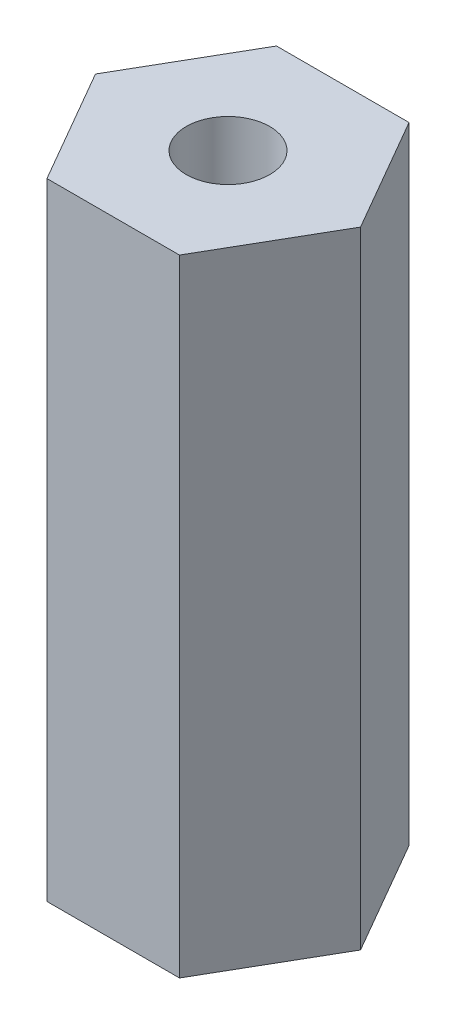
SolidWorks part; units mm, degrees
ref_plane "Alzado" through (0, 0, 0) normal (0, 0, 1) x (1, 0, 0)
ref_plane "Planta" through (0, 0, 0) normal (0, 1, 0) x (1, 0, 0)
ref_plane "Vista lateral" through (0, 0, 0) normal (1, 0, 0) x (0, 0, -1)
sketch "Croquis1" plane through (0, 0, 0) normal (0, 1, 0) x (1, 0, 0)
  line L1 (1.5877, 2.75) -> (-1.5877, 2.75)
  line L2 (-1.5877, 2.75) -> (-3.1754, 0)
  line L3 (-3.1754, 0) -> (-1.5877, -2.75)
  line L4 (-1.5877, -2.75) -> (1.5877, -2.75)
  line L5 (1.5877, -2.75) -> (3.1754, 0)
  line L6 (3.1754, 0) -> (1.5877, 2.75)
  circle A0 centre (0, 0) radius 2.75 construction
  dimension "D1" = 5.5
extrude "Saliente-Extruir1" add sketch "Croquis1" along normal blind 15
sketch "Croquis2" plane through (0, 15, 0) normal (0, 1, 0) x (1, 0, 0)
  circle A0 centre (0, 0) radius 1
  dimension "D1" = 2
extrude "Cortar-Extruir1" cut sketch "Croquis2" against normal through all
